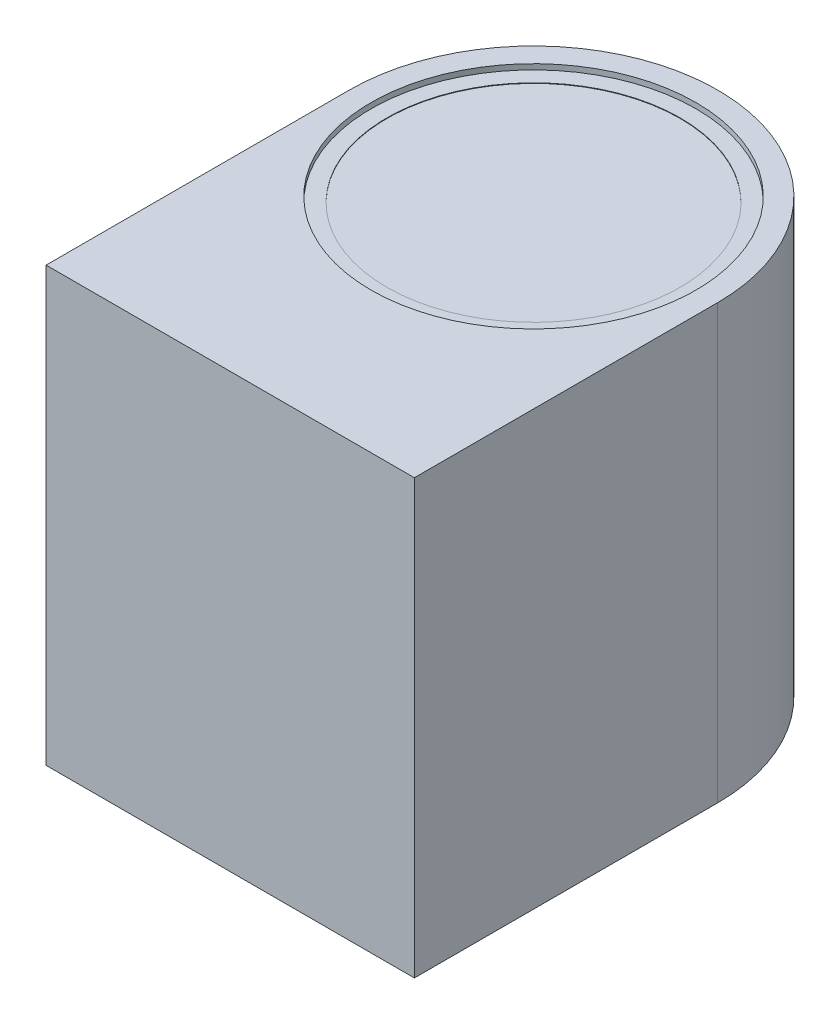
SolidWorks part; units mm, degrees
ref_plane "Alzado" through (0, 0, 0) normal (0, 0, 1) x (1, 0, 0)
ref_plane "Planta" through (0, 0, 0) normal (0, 1, 0) x (1, 0, 0)
ref_plane "Vista lateral" through (0, 0, 0) normal (1, 0, 0) x (0, 0, -1)
sketch "Croquis1" plane through (0, 0, 0) normal (0, 1, 0) x (1, 0, 0)
  line L0 (-34, 0) -> (-34, -56)
  line L1 (-34, -56) -> (34, -56)
  line L2 (34, -56) -> (34, 0)
  arc A0 (34, 0) -> (-34, 0) centre (0, 0) ccw
  point P1 (0, 34)
  dimension "D1" = 90
  dimension "D2" = 68
extrude "Saliente-Extruir1" add sketch "Croquis1" along normal blind 80
sketch "Croquis2" plane through (0, 80, 0) normal (0, 1, 0) x (1, 0, 0)
  circle A0 centre (0, 0) radius 30
extrude "Cortar-Extruir1" cut sketch "Croquis2" against normal blind 1
sketch "Croquis3" plane through (0, 79, 0) normal (0, 1, 0) x (1, 0, 0)
  circle A0 centre (0, 0) radius 27.0917
extrude "Cortar-Extruir2" cut sketch "Croquis3" against normal blind 0.1
